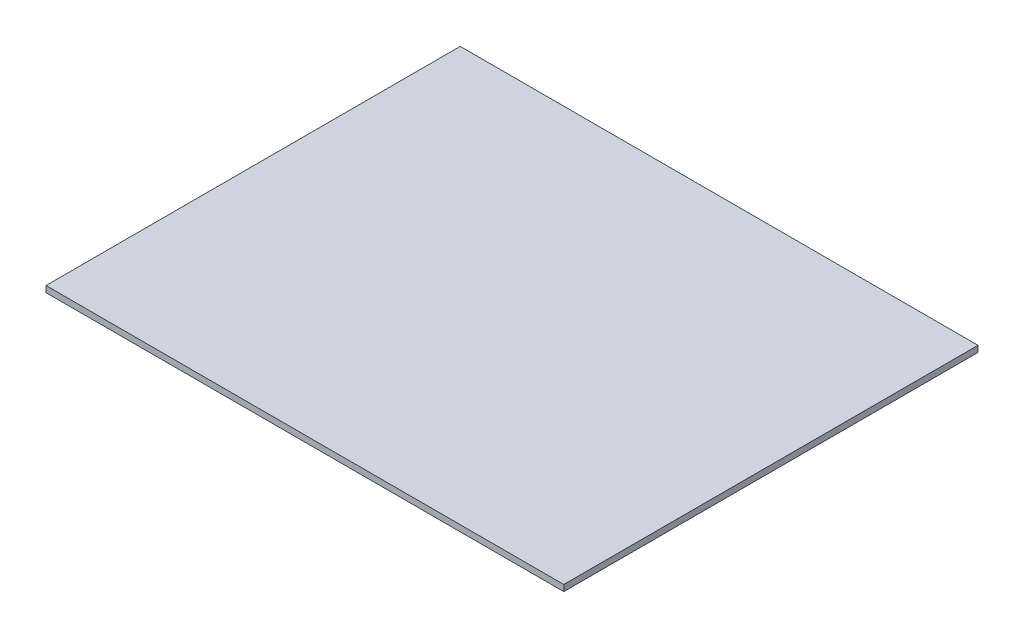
SolidWorks part; units mm, degrees
ref_plane "Front Plane" through (0, 0, 0) normal (0, 0, 1) x (1, 0, 0)
ref_plane "Top Plane" through (0, 0, 0) normal (0, 1, 0) x (1, 0, 0)
ref_plane "Right Plane" through (0, 0, 0) normal (1, 0, 0) x (0, 0, -1)
sketch "Sketch1" plane through (0, 0, 0) normal (0, 1, 0) x (1, 0, 0)
  line L1 (-1219.2, 609.6) -> (1219.2, 609.6)
  line L2 (-1219.2, 609.6) -> (-1219.2, -609.6)
  line L3 (-1219.2, -609.6) -> (1219.2, -609.6)
  line L4 (1219.2, 609.6) -> (1219.2, -609.6)
  line L5 (-1219.2, 609.6) -> (1219.2, -609.6) construction
  line L6 (-1219.2, -609.6) -> (1219.2, 609.6) construction
  point P0 (0, 0)
  dimension "D1" = 2438.4
  dimension "D2" = 1219.2
extrude "Boss-Extrude1" add sketch "Sketch1" along normal blind 18.2562
sketch "Sketch2" plane through (0, 18.2562, 0) normal (0, 1, 0) x (1, 0, 0)
  line L0 (-1219.2, -609.6) -> (1219.2, -609.6) construction
  line L1 (1219.2, 609.6) -> (304.8, 609.6)
  line L2 (1219.2, 609.6) -> (1219.2, -609.6)
  line L3 (1219.2, -609.6) -> (304.8, -609.6)
  line L4 (304.8, 609.6) -> (304.8, -609.6)
  dimension "D1" = 914.4
extrude "Cut-Extrude1" cut sketch "Sketch2" against normal through all
sketch "Sketch3" [suppressed] plane through (0, 18.2562, 0) normal (0, 1, 0) x (1, 0, 0)
  line L0 (304.8, 609.6) -> (304.8, -609.6) construction
  line L1 (-1219.2, -609.6) -> (304.8, -609.6)
  line L2 (-1219.2, -609.6) -> (-1219.2, -400.05)
  line L3 (-1219.2, -400.05) -> (304.8, -400.05)
  line L4 (304.8, -609.6) -> (304.8, -400.05)
  dimension "D1" = 209.55
extrude "Cut-Extrude2" [suppressed] cut sketch "Sketch3" against normal through all
hole_wizard "CSK for #8 Flat Head Machine Screw (100)1" positions "3DSketch1" profile "Sketch4" countersink size "#8" standard "ANSI Inch"
sketch3d "3DSketch1"
  line L0 (-1219.2, 18.2563, -590.55) -> (304.8, 18.2563, -590.55) construction
  line L1 (-1219.2, 18.2562, -609.6) -> (-1219.2, 18.2562, 609.6) construction
  line L2 (304.8, 18.2562, -609.6) -> (304.8, 18.2562, 609.6) construction
  line L4 (304.8, 18.2562, -609.6) -> (-1219.2, 18.2562, -609.6) construction
  point P2 (-952.5, 18.2562, -590.55)
  point P4 (-609.6, 18.2562, -590.55)
  point P6 (-304.8, 18.2562, -590.55)
  point P8 (38.1, 18.2562, -590.55)
  dimension "D1" = 19.05
  dimension "D2" = 266.7
  dimension "D3" = 609.6
  dimension "D4" = 609.6
  dimension "D5" = 266.7
sketch "Sketch4" plane through (-952.5, 18.2562, -590.55) normal (1, 0, 0) x (0, 0, 1)
  line L0 (0, 0) -> (0, 18.2562)
  line L1 (0, 18.2562) -> (2.2479, 18.2562)
  line L2 (2.2479, 18.2562) -> (2.2479, 1.6518)
  line L3 (2.2479, 1.6518) -> (4.2164, 0)
  line L5 (4.2164, 0) -> (0, 0)
  line L6 (-2.2479, 1.6518) -> (-4.2164, 0) construction
  line L11 (0, -6.35) -> (0, 107.95) construction
  dimension "Thru Hole Dia." = 4.4958
  dimension "Thru Hole Depth" = 18.2562
  dimension "Near C'Sink Dia." = 8.4328
  dimension "Near C'Sink Angle" = 100
hole_wizard "CSK for #8 Flat Head Machine Screw (100)2" positions "Sketch6" profile "Sketch5" countersink size "#8" standard "ANSI Inch"
sketch "Sketch6" plane through (0, 18.2562, 0) normal (0, 1, 0) x (1, 0, 0)
  line L0 (-1219.2, -590.55) -> (304.8, -590.55) construction
  line L1 (-1219.2, 609.6) -> (-1219.2, -609.6) construction
  line L2 (304.8, 609.6) -> (304.8, -609.6) construction
  line L4 (-1219.2, -609.6) -> (304.8, -609.6) construction
  line L5 (-1200.15, 609.6) -> (-1200.15, -609.6) construction
  line L6 (304.8, 609.6) -> (-1219.2, 609.6) construction
  line L8 (285.75, 609.6) -> (285.75, -609.6) construction
  line L10 (-1219.2, 438.15) -> (304.8, 438.15) construction
  line L12 (-1219.2, 219.075) -> (304.8, 219.075) construction
  line L14 (-1219.2, 0) -> (304.8, 0) construction
  line L16 (-1219.2, -241.3) -> (304.8, -241.3) construction
  line L18 (-1219.2, -479.425) -> (304.8, -479.425) construction
  point P0 (-1066.8, -590.55)
  point P2 (-812.8, -590.55)
  point P4 (-101.6, -590.55)
  point P6 (152.4, -590.55)
  point P8 (-1200.15, 438.15)
  point P10 (-1200.15, 219.075)
  point P12 (-1200.15, 0)
  point P14 (-1200.15, -241.3)
  point P16 (-1200.15, -479.425)
  point P18 (285.75, -479.425)
  point P20 (285.75, -241.3)
  point P22 (285.75, 0)
  point P24 (285.75, 219.075)
  point P26 (285.75, 438.15)
  dimension "D1" = 19.05
  dimension "D2" = 19.05
  dimension "D3" = 19.05
  dimension "D4" = 171.45
  dimension "D5" = 390.525
  dimension "D6" = 609.6
  dimension "D7" = 850.9
  dimension "D8" = 130.175
  dimension "D9" = 152.4
  dimension "D10" = 406.4
  dimension "D11" = 406.4
  dimension "D12" = 152.4
sketch "Sketch5" plane through (-1066.8, 18.2562, 590.55) normal (1, 0, 0) x (0, 0, 1)
  line L0 (0, 0) -> (0, 18.2562)
  line L1 (0, 18.2562) -> (2.2479, 18.2562)
  line L2 (2.2479, 18.2562) -> (2.2479, 1.6518)
  line L3 (2.2479, 1.6518) -> (4.2164, 0)
  line L5 (4.2164, 0) -> (0, 0)
  line L6 (-2.2479, 1.6518) -> (-4.2164, 0) construction
  line L11 (0, -6.35) -> (0, 107.95) construction
  dimension "Thru Hole Dia." = 4.4958
  dimension "Thru Hole Depth" = 18.2562
  dimension "Near C'Sink Dia." = 8.4328
  dimension "Near C'Sink Angle" = 100
hole_wizard "CSK for #8 Flat Head Machine Screw (100)3" positions "Sketch8" profile "Sketch7" countersink size "#8" standard "ANSI Inch"
sketch "Sketch8" plane through (0, 18.2562, 0) normal (0, 1, 0) x (1, 0, 0)
  line L0 (-1200.15, 609.6) -> (-1200.15, -400.05) construction
  line L1 (304.8, 609.6) -> (-1219.2, 609.6) construction
  line L2 (304.8, -400.05) -> (-1219.2, -400.05) construction
  line L4 (-1219.2, 590.55) -> (304.8, 590.55) construction
  line L5 (-1219.2, 609.6) -> (-1219.2, -400.05) construction
  line L6 (304.8, 609.6) -> (304.8, -400.05) construction
  line L8 (285.75, 609.6) -> (285.75, -400.05) construction
  line L10 (-1219.2, -381) -> (304.8, -381) construction
  line L12 (-1219.2, 441.325) -> (304.8, 441.325) construction
  line L14 (-1219.2, 228.6) -> (304.8, 228.6) construction
  line L16 (-1219.2, -19.05) -> (304.8, -19.05) construction
  line L18 (-1219.2, -231.775) -> (304.8, -231.775) construction
  point P0 (-1200.15, 441.325)
  point P2 (-1200.15, 228.6)
  point P4 (-1200.15, -19.05)
  point P6 (-1200.15, -231.775)
  point P8 (285.75, -231.775)
  point P10 (285.75, -19.05)
  point P12 (285.75, 228.6)
  point P14 (285.75, 441.325)
  point P16 (-1066.8, 590.55)
  point P18 (-812.8, 590.55)
  point P20 (-101.6, 590.55)
  point P22 (152.4, 590.55)
  point P24 (-1079.5, -381)
  point P26 (-584.2, -381)
  point P28 (-330.2, -381)
  point P30 (165.1, -381)
  dimension "D1" = 19.05
  dimension "D2" = 19.05
  dimension "D3" = 19.05
  dimension "D4" = 19.05
  dimension "D5" = 168.275
  dimension "D6" = 381
  dimension "D7" = 381
  dimension "D8" = 168.275
  dimension "D9" = 152.4
  dimension "D10" = 406.4
  dimension "D11" = 406.4
  dimension "D12" = 152.4
  dimension "D13" = 139.7
  dimension "D14" = 635
  dimension "D15" = 635
  dimension "D16" = 139.7
sketch "Sketch7" plane through (-1200.15, 18.2562, -441.325) normal (1, 0, 0) x (0, 0, 1)
  line L0 (0, 0) -> (0, 18.2562)
  line L1 (0, 18.2562) -> (2.2479, 18.2562)
  line L2 (2.2479, 18.2562) -> (2.2479, 1.6518)
  line L3 (2.2479, 1.6518) -> (4.2164, 0)
  line L5 (4.2164, 0) -> (0, 0)
  line L6 (-2.2479, 1.6518) -> (-4.2164, 0) construction
  line L11 (0, -6.35) -> (0, 107.95) construction
  dimension "Thru Hole Dia." = 4.4958
  dimension "Thru Hole Depth" = 18.2562
  dimension "Near C'Sink Dia." = 8.4328
  dimension "Near C'Sink Angle" = 100
